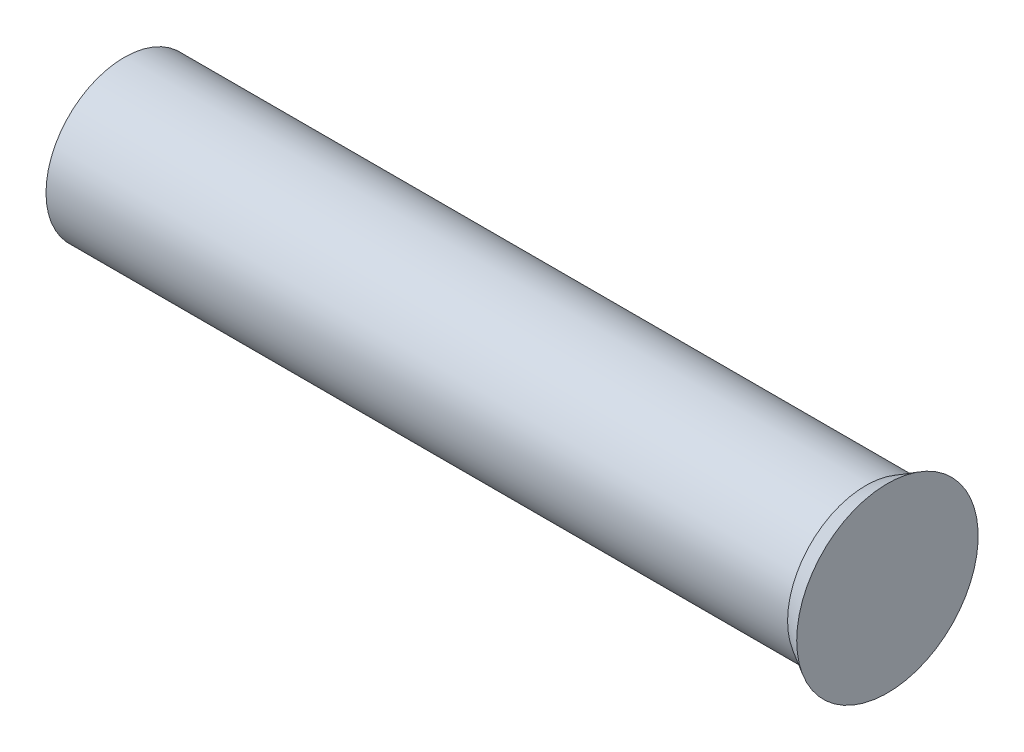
SolidWorks part; units mm, degrees
ref_plane "Front Plane" through (0, 0, 0) normal (0, 0, 1) x (1, 0, 0)
ref_plane "Top Plane" through (0, 0, 0) normal (0, 1, 0) x (1, 0, 0)
ref_plane "Right Plane" through (0, 0, 0) normal (1, 0, 0) x (0, 0, -1)
sketch "Sketch1" plane through (0, 0, 0) normal (0, 0, 1) x (1, 0, 0)
  line L0 (3.8669, 0) -> (83.0819, 0) construction
  line L1 (0.5227, 1.9939) -> (19.4145, 1.9939)
  line L2 (19.4145, 1.9939) -> (19.9644, 2.3114)
  line L3 (19.9644, 2.3114) -> (19.9644, 0)
  line L4 (19.9644, 0) -> (0, 0)
  arc A0 (0, 0) -> (0.5227, 1.9939) centre (4.064, 0) cw
  dimension "D1" = 4.064
  dimension "D2" = 30
  dimension "D3" = 4.6228
  dimension "D4" = 19.9644
  dimension "D5" = 3.9878
revolve "Revolve1" add sketch "Sketch1" angle 360 about L0
